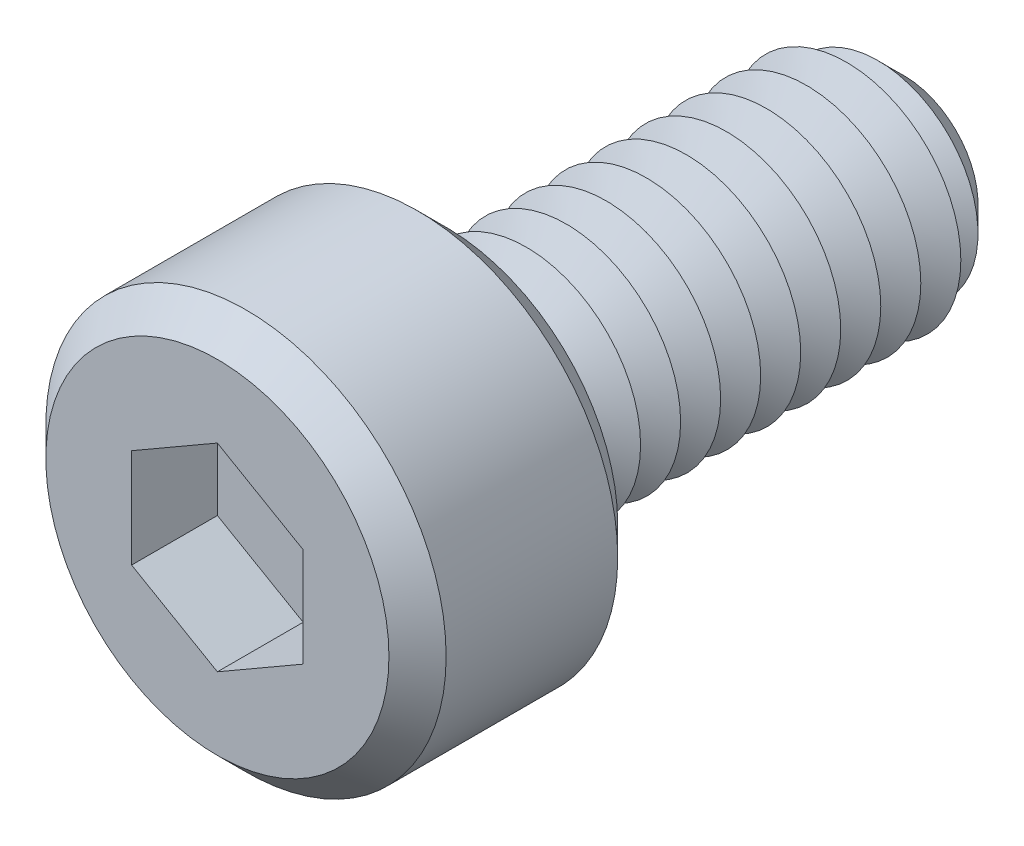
SolidWorks part; units mm, degrees
ref_plane "Front Plane" through (0, 0, 0) normal (0, 0, 1) x (1, 0, 0)
ref_plane "Top Plane" through (0, 0, 0) normal (0, 1, 0) x (1, 0, 0)
ref_plane "Right Plane" through (0, 0, 0) normal (1, 0, 0) x (0, 0, -1)
sketch "Sketch1" plane through (0, 0, 0) normal (0, 0, 1) x (1, 0, 0)
  circle A0 centre (0, 0) radius 3.5
  dimension "D1" = 7
extrude "Boss-Extrude1" add sketch "Sketch1" along normal blind 4
sketch "Sketch2" plane through (0, 0, 0) normal (0, 0, -1) x (-1, 0, 0)
  circle A0 centre (0, 0) radius 2
  dimension "D1" = 4
extrude "Boss-Extrude2" add sketch "Sketch2" along normal blind 8
chamfer "Chamfer1" distance 0.7 angle 45 1 edges at (-2, 0, -8)
sketch "Sketch3" plane through (0, 0, 0) normal (1, 0, 0) x (0, 0, -1)
  line L0 (-2.5121, 0) -> (4.5776, 0) construction
sketch "Sketch4" plane through (0, 0, 0) normal (1, 0, 0) x (0, 0, -1)
  line L0 (0, 2) -> (0.35, 1.3938)
  line L1 (0.35, 1.3938) -> (0.7, 2)
  line L2 (7.3, 2) -> (0, 2) construction
  line L3 (0.7, 2) -> (0, 2)
  dimension "D1" = 0.7
revolve "Cut-Revolve1" cut sketch "Sketch4" angle 360 about L0
pattern_linear "LPattern1" count 11 spacing 0.7 along (0, 0, -1) of "Cut-Revolve1"
sketch "Sketch5" plane through (0, 0, 4) normal (0, 0, 1) x (1, 0, 0)
  line L1 (0, 1.7321) -> (-1.5, 0.866)
  line L2 (-1.5, 0.866) -> (-1.5, -0.866)
  line L3 (-1.5, -0.866) -> (0, -1.7321)
  line L4 (0, -1.7321) -> (1.5, -0.866)
  line L5 (1.5, -0.866) -> (1.5, 0.866)
  line L6 (1.5, 0.866) -> (0, 1.7321)
  circle A0 centre (0, 0) radius 1.5 construction
  dimension "D1" = 3
extrude "Cut-Extrude1" cut sketch "Sketch5" against normal blind 1.5
sketch "Sketch6" plane through (0, 0, 2.5) normal (0, 0, 1) x (1, 0, 0)
  circle A0 centre (0, 0) radius 0.5
  dimension "D1" = 1
extrude "Cut-Extrude2" cut sketch "Sketch6" against normal up to surface (10.5 mm away)
chamfer "Chamfer2" distance 0.5 angle 45 2 edges at (3.5, 0, 0) (3.5, 0, 4)
